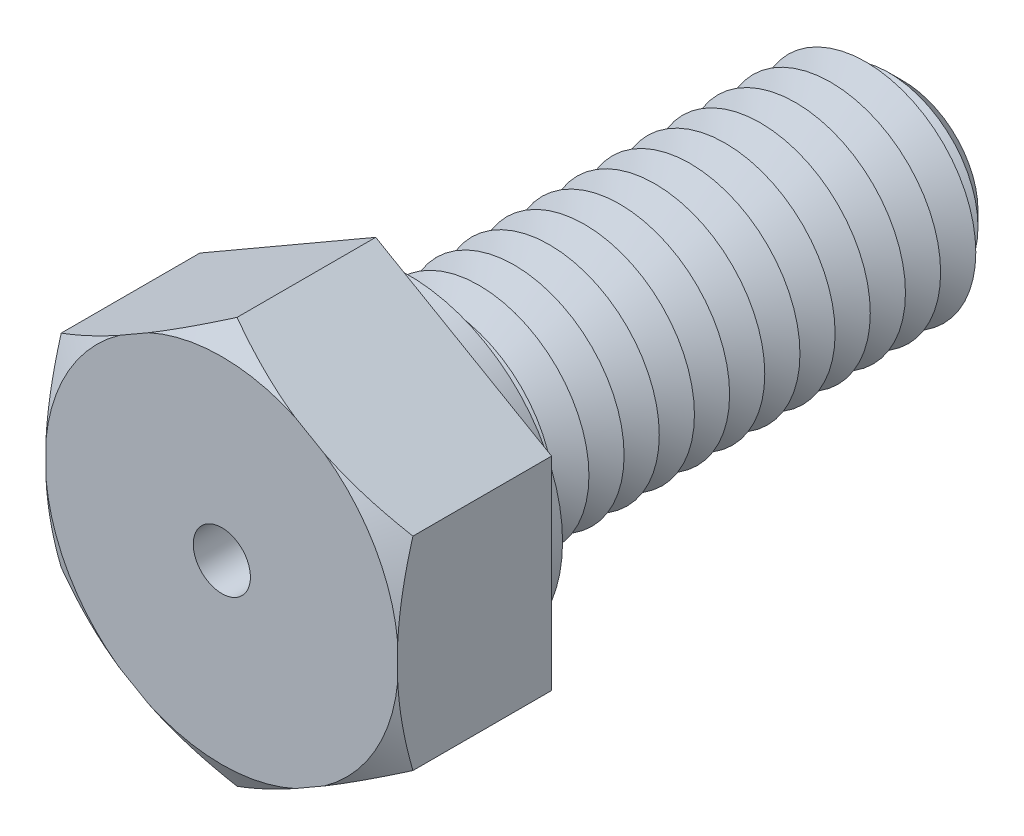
SolidWorks part; units mm, degrees
ref_plane "Front Plane" through (0, 0, 0) normal (0, 0, 1) x (1, 0, 0)
ref_plane "Top Plane" through (0, 0, 0) normal (0, 1, 0) x (1, 0, 0)
ref_plane "Right Plane" through (0, 0, 0) normal (1, 0, 0) x (0, 0, -1)
sketch "Sketch2" plane through (0, 0, 0) normal (0, 0, 1) x (1, 0, 0)
  line L1 (0, 4.6188) -> (-4, 2.3094)
  line L2 (-4, 2.3094) -> (-4, -2.3094)
  line L3 (-4, -2.3094) -> (0, -4.6188)
  line L4 (0, -4.6188) -> (4, -2.3094)
  line L5 (4, -2.3094) -> (4, 2.3094)
  line L6 (4, 2.3094) -> (0, 4.6188)
  circle A0 centre (0, 0) radius 4 construction
  dimension "D1" = 8
extrude "Boss-Extrude1" add sketch "Sketch2" along normal blind 3.5
sketch "Sketch3" plane through (0, 0, 0) normal (0, 0, -1) x (-1, 0, 0)
  circle A0 centre (0, 0) radius 2.5
  dimension "D1" = 5
extrude "Boss-Extrude2" add sketch "Sketch3" along normal blind 12
sketch "Sketch4" plane through (0, 0, 0) normal (0, 0, -1) x (-1, 0, 0)
  circle A0 centre (0, 0) radius 3.5
  dimension "D1" = 7
extrude "Boss-Extrude3" add sketch "Sketch4" along normal blind 0.75
sketch "Sketch5" plane through (0, 0, 0) normal (1, 0, 0) x (0, 0, -1)
  line L0 (-3.2117, 0) -> (6.3192, 0) construction
chamfer "Chamfer1" distance 0.8 angle 45 1 edges at (-2.5, 0, -12)
sketch "Sketch6" plane through (0, 0, 0) normal (1, 0, 0) x (0, 0, -1)
  line L0 (0.75, 2.5) -> (1.15, 1.8072)
  line L1 (1.15, 1.8072) -> (1.55, 2.5)
  line L2 (11.2, 2.5) -> (0.75, 2.5) construction
  line L3 (1.55, 2.5) -> (0.75, 2.5)
  dimension "D1" = 0.8
revolve "Cut-Revolve1" cut sketch "Sketch6" angle 360 about L0
pattern_linear "LPattern1" count 14 spacing 0.8 along (0, 0, -1) of "Cut-Revolve1"
sketch "Sketch7" plane through (0, 0, 0) normal (1, 0, 0) x (0, 0, -1)
  line L0 (-3.5, 4.6188) -> (-3.5, 4.0188)
  line L1 (-3.5, 2.3094) -> (-3.5, 4.6188) construction
  line L2 (-3.5, 4.0188) -> (-3.1536, 4.6188)
  line L3 (-3.5, 4.6188) -> (0, 4.6188) construction
  line L4 (-3.1536, 4.6188) -> (-3.5, 4.6188)
  dimension "D1" = 0.6
  dimension "D2" = 30
revolve "Cut-Revolve2" cut sketch "Sketch7" angle 360 about L0
sketch "Sketch8" plane through (0, 0, 3.5) normal (0, 0, 1) x (1, 0, 0)
  circle A0 centre (0, 0) radius 0.65
  dimension "D1" = 1.3
extrude "Cut-Extrude1" cut sketch "Sketch8" against normal up to surface (15.5 mm away)
